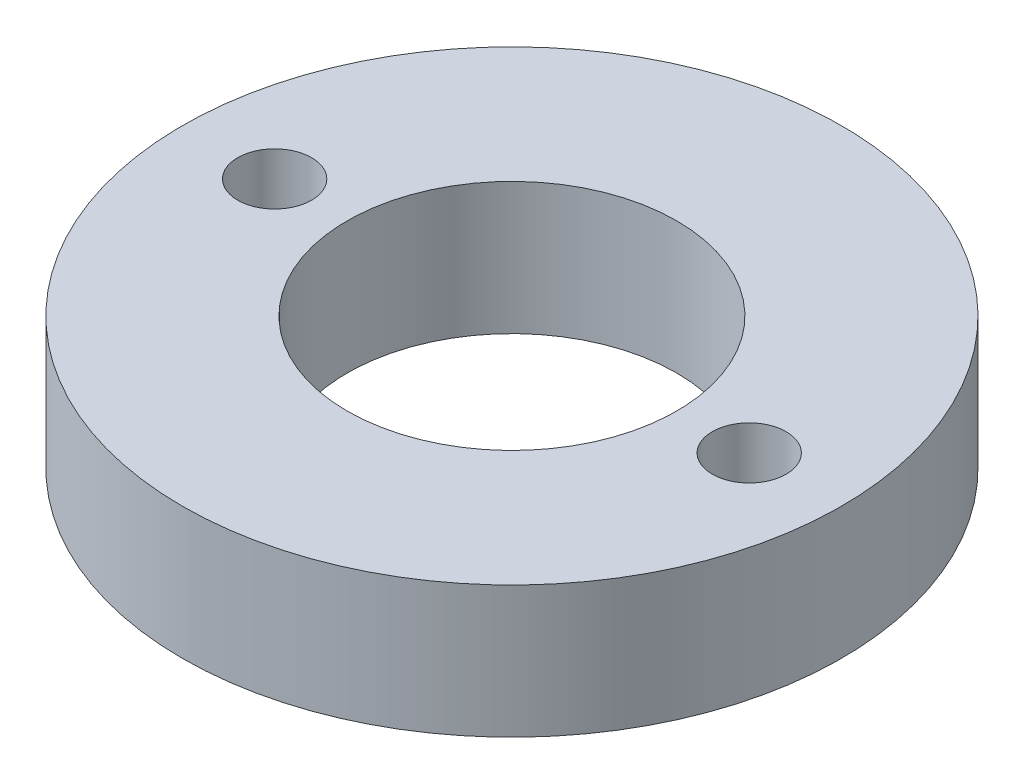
SolidWorks part; units mm, degrees
ref_plane "Front Plane" through (0, 0, 0) normal (0, 0, 1) x (1, 0, 0)
ref_plane "Top Plane" through (0, 0, 0) normal (0, 1, 0) x (1, 0, 0)
ref_plane "Right Plane" through (0, 0, 0) normal (1, 0, 0) x (0, 0, -1)
sketch "Sketch1" plane through (0, 0, 0) normal (0, 1, 0) x (1, 0, 0)
  line L0 (-11.43, 0) -> (11.43, 0) construction
  circle A0 centre (0, 0) radius 7.9375
  circle A1 centre (0, 0) radius 15.875
  circle A2 centre (-11.43, 0) radius 1.778
  circle A3 centre (11.43, 0) radius 1.778
  dimension "D1" = 22.86
  dimension "D2" = 15.875
  dimension "D3" = 31.75
  dimension "D4" = 3.556
extrude "Boss-Extrude1" add sketch "Sketch1" along normal blind 6.35
